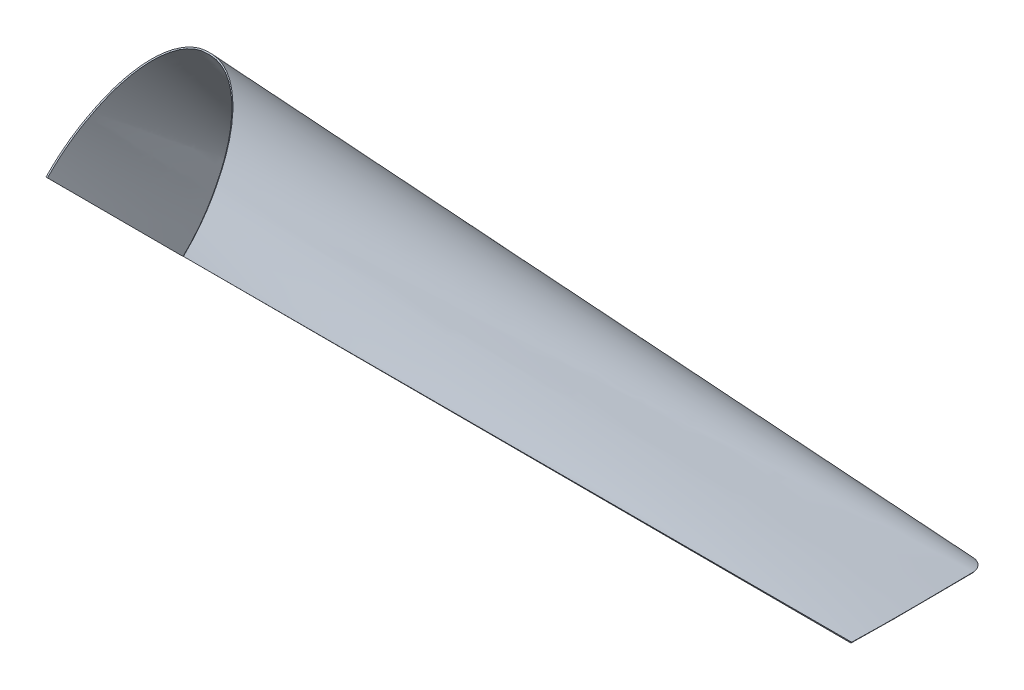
SolidWorks part; units mm, degrees
ref_plane "Ebene vorne" through (0, 0, 0) normal (0, 0, 1) x (1, 0, 0)
ref_plane "Ebene oben" through (0, 0, 0) normal (0, 1, 0) x (1, 0, 0)
ref_plane "Ebene rechts" through (0, 0, 0) normal (1, 0, 0) x (0, 0, -1)
sketch "Skizze1" plane through (0, 0, 0) normal (0, 1, 0) x (1, 0, 0)
  line L0 (-250.4363, 50) -> (250.4363, 50) construction
  line L1 (-240.0869, 100) -> (240.0869, 100)
  line L2 (-250.0865, 90.0873) -> (-250.4363, 50)
  line L3 (-250, 0) -> (250, 0) construction
  line L4 (250.0865, 90.0873) -> (250.4363, 50)
  line L5 (-250, 100) -> (250, 0) construction
  line L6 (-250, 0) -> (250, 100) construction
  line L7 (0, 100) -> (0, 0) construction
  arc A0 (-240.0869, 100) -> (-250.0865, 90.0873) centre (-240.0869, 90) ccw
  arc A1 (250.0865, 90.0873) -> (240.0869, 100) centre (240.0869, 90) ccw
  arc A2 (-250.4363, 50) -> (-250, 0) centre (1182.0309, 37.499) ccw
  arc A3 (250.4363, 50) -> (250, 0) centre (-1182.0309, 37.499) cw
  point P0 (0, 50)
  dimension "D3" = 10
  dimension "D1" = 500
  dimension "D2" = 100
  dimension "D4" = 89.5
  dimension "D5" = 89.5
ref_plane "Ebene1" through (0, -25, -25) normal (0, 0.7071, 0.7071) x (1, 0, 0)
sketch "Skizze2" plane through (0, -25, -25) normal (0, 0.7071, 0.7071) x (1, 0, 0)
  line L0 (0, 0) -> (0, -73.5485) construction
  line L1 (0, 0) -> (87.6148, 0) construction
ref_plane "Ebene2" through (15.3093, -18.75, -18.75) normal (-0.5, 0.6124, 0.6124) x (0.866, 0.3536, 0.3536)
ref_plane "Ebene3" through (-134.6907, 164.9617, 164.9617) normal (-0.5, 0.6124, 0.6124) x (0.866, 0.3536, 0.3536)
sketch "Skizze3" plane through (-134.6907, 164.9617, 164.9617) normal (-0.5, 0.6124, 0.6124) x (0.866, 0.3536, 0.3536)
  line L0 (0, 0) -> (100, 0) construction
  line L1 (0, 0) -> (0, 100) construction
  line L2 (0, 0) -> (-100, 0) construction
  line L3 (0, 0) -> (0, -100) construction
  line L4 (-3, 99.955) -> (3, 99.955)
  line L5 (-90.9592, 42.415) -> (0, 0) construction
  line L6 (-90.9592, 42.415) -> (-92.5617, 38.75)
  line L8 (90.9592, 42.415) -> (92.5617, 38.75)
  circle A0 centre (0, 0) radius 100 construction
  arc A1 (-3, 99.955) -> (-90.9592, 42.415) centre (-3, 3.955) ccw
  arc A2 (-92.5617, 38.75) -> (-100, 0) centre (-10.6641, 2.9405) ccw
  arc A3 (3, 99.955) -> (90.9592, 42.415) centre (3, 3.955) cw
  arc A4 (92.5617, 38.75) -> (100, 0) centre (10.6641, 2.9405) cw
  point P9 (0, 99.955)
  dimension "D1" = 200
  dimension "D2" = 6
  dimension "D3" = 4
  dimension "D5" = 96
  dimension "D4" = 25
sheet metal parameters "Blech1" thickness 1 parameters "D1"=3, "Dicke"=1
lofted bend "Ausgeformte Biegungen1" parameters "D1"=0, "D12"=1
other "Freiform-Biegung1" parameters "D1"=1000, "D4"=57.296, "D5"=1
sketch3d "3D-Skizze2"
  line L0 (-250.0865, 0, -90.0873) -> (-213.4637, 162.7947, 102.8109)
  line L1 (-214.8515, 159.6366, 104.8358) -> (-250.4363, 0, -50)
  line L2 (-240.0869, 0, -100) -> (-137.2888, 234.5799, 93.2222)
  line L3 (-132.0926, 236.7012, 95.3435) -> (240.0869, 0, -100)
  line L4 (250.0865, 0, -90.0873) -> (-55.9177, 227.1126, 167.1288)
  line L5 (-54.5299, 225.0877, 170.2868) -> (250.4363, 0, -50)
  line L6 (-49.4341, 213.7616, 185.7735) -> (250.4363, 0, -24.9981)
  line L7 (-86.5795, 244.2067, 124.9994) -> (247.127, 0, -97.1019)
  line L8 (-182.8018, 204.9241, 85.7168) -> (-247.127, 0, -97.1019)
  line L9 (-219.9472, 144.1499, 116.1618) -> (-250.4363, 0, -24.9981)
  arc A0 (-54.5299, 225.0877, 170.2868) -> (-48.0881, 200.3171, 200.3171) centre (-125.4553, 170.8113, 166.6529) ccw construction
  arc A1 (250.4363, 0, -50) -> (250, 0, 0) centre (-1182.0309, 0, -37.499) ccw construction
  arc A2 (-132.0926, 236.7012, 95.3435) -> (-55.9177, 227.1126, 167.1288) centre (-132.0926, 168.819, 163.2258) ccw construction
  arc A3 (250.0865, 0, -90.0873) -> (240.0869, 0, -100) centre (240.0869, 0, -90) ccw construction
  arc A4 (-137.2888, 234.5799, 93.2222) -> (-213.4637, 162.7947, 102.8109) centre (-137.2888, 166.6977, 161.1045) ccw construction
  arc A5 (-240.0869, 0, -100) -> (-250.0865, 0, -90.0873) centre (-240.0869, 0, -90) ccw construction
  arc A6 (-214.8515, 159.6366, 104.8358) -> (-221.2932, 129.6064, 129.6064) centre (-143.9261, 163.2706, 159.1122) ccw construction
  arc A7 (-250.4363, 0, -50) -> (-250, 0, 0) centre (1182.0309, 0, -37.499) ccw construction
  point P29 (-80.7632, 116.0748, 111.9164)
  point P33 (-1182.0309, -1432.5218, -37.499)
  point P39 (-84.0926, 110.0312, 104.438)
  point P43 (240.0869, 10, -90)
  point P49 (-185.2888, 225.4854, 219.8922)
  point P53 (-240.0869, 10, -90)
  point P59 (-188.6182, 218.0071, 213.8486)
  point P63 (1182.0309, 1432.5218, -37.499)
flat pattern "Abwicklung1"
sketch "Biegung-Linien1" plane through (0, 0, 0) normal (0, 1, 0) x (-1, 0, 0)
other "Abwickeln-<Freiform-Biegung1>1"
